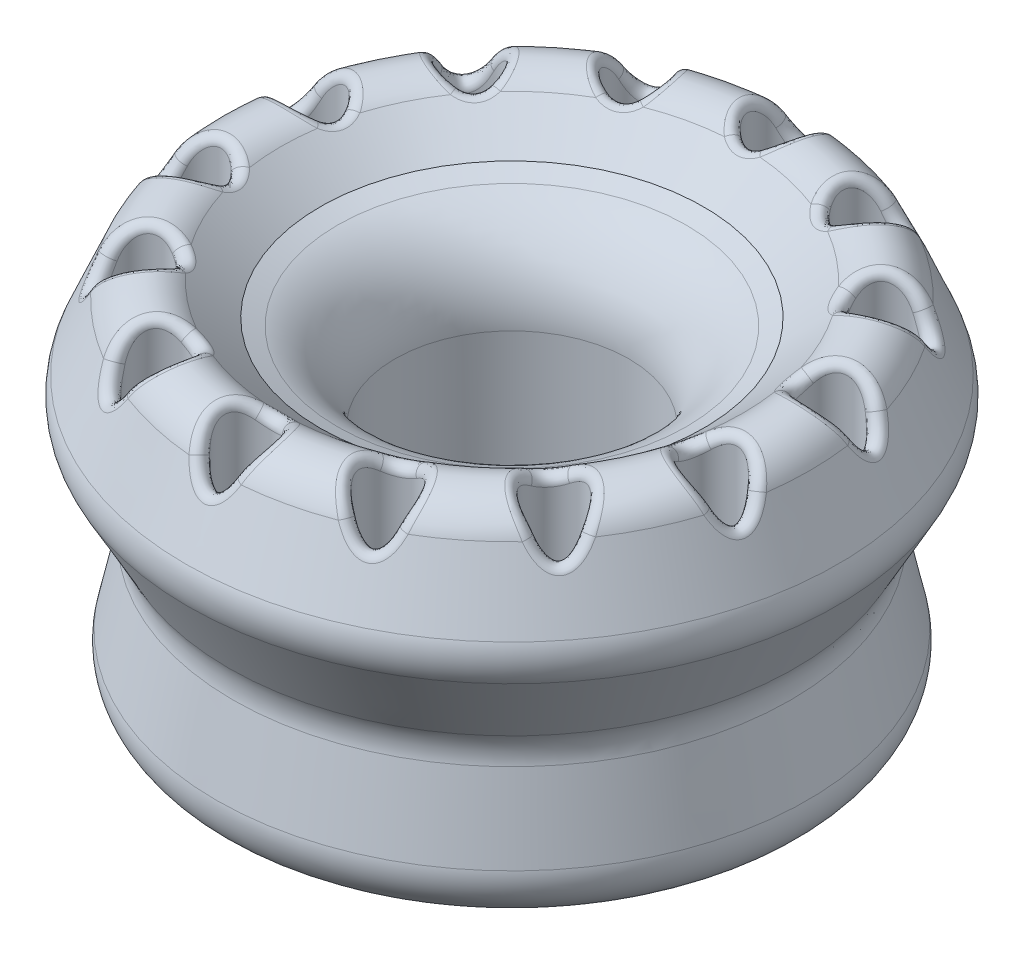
SolidWorks part; units mm, degrees
ref_plane "Front Plane" through (0, 0, 0) normal (0, 0, 1) x (1, 0, 0)
ref_plane "Top Plane" through (0, 0, 0) normal (0, 1, 0) x (1, 0, 0)
ref_plane "Right Plane" through (0, 0, 0) normal (1, 0, 0) x (0, 0, -1)
sketch "Sketch1" plane through (0, 0, 0) normal (0, 0, 1) x (1, 0, 0)
  line L0 (0, 96.2863) -> (0, -61.8464) construction
  line L1 (-98.9542, 40.0182) -> (-81.4917, 81.2491)
  line L2 (-81.4917, 81.2491) -> (-56.7531, 60.6337)
  line L3 (-56.7531, 60.6337) -> (-34.6111, 51.2559)
  line L4 (-34.6111, 51.2559) -> (-34.6111, -41.9585)
  line L5 (-34.6111, -41.9585) -> (-90.2229, -32.2571)
  line L6 (-90.2229, -32.2571) -> (-81.4917, 8.4887)
  line L7 (-81.4917, 8.4887) -> (-98.9542, 40.0182)
revolve "Revolve1" add sketch "Sketch1" angle 360 about L0
fillet "Fillet1" radius 12.7 4 edges at (0, 81.2491, 81.4917) (0, -32.2571, 90.2229) (0, 40.0182, 98.9542) (0, 8.4887, 81.4917)
fillet "Fillet2" radius 27.94 1 edges at (0, 51.2559, 34.6111)
ref_plane "Plane1" through (0, 47.5756, 0) normal (0, 1, 0) x (-1, 0, 0)
sketch "Sketch2" plane through (0, 47.5756, 0) normal (0, 1, 0) x (-1, 0, 0)
  circle A0 centre (0, 78.5109) radius 7.7373
extrude "Cut-Extrude1" cut sketch "Sketch2" along normal through all
pattern_circular "CirPattern1" count 14 over 360 about axis through (0, 0, 0) along (0, 1, 0) of "Cut-Extrude1"
fillet "Fillet3" radius 2.54 14 edges at (38.1194, 68.6869, 77.3256) (65.9977, 68.9167, 55.1608) (81.2638, 70.276, 23.6002) (80.987, 72.0869, -11.1369) (65.2076, 73.1769, -42.2252) (33.76, 72.2122, -63.0046) (2.9216, 72.1806, -71.3464) (-30.6799, 71.8844, -63.7782) (-58.0886, 72.2846, -41.9495) (-72.6666, 72.8726, -10.7738) (-70.2565, 72.9093, 21.9817) (-57.3518, 72.7783, 55.5554) (-30.6918, 71.0858, 77.6994) (2.5428, 69.093, 85.8184)
shell "Shell1" thickness 2.54
